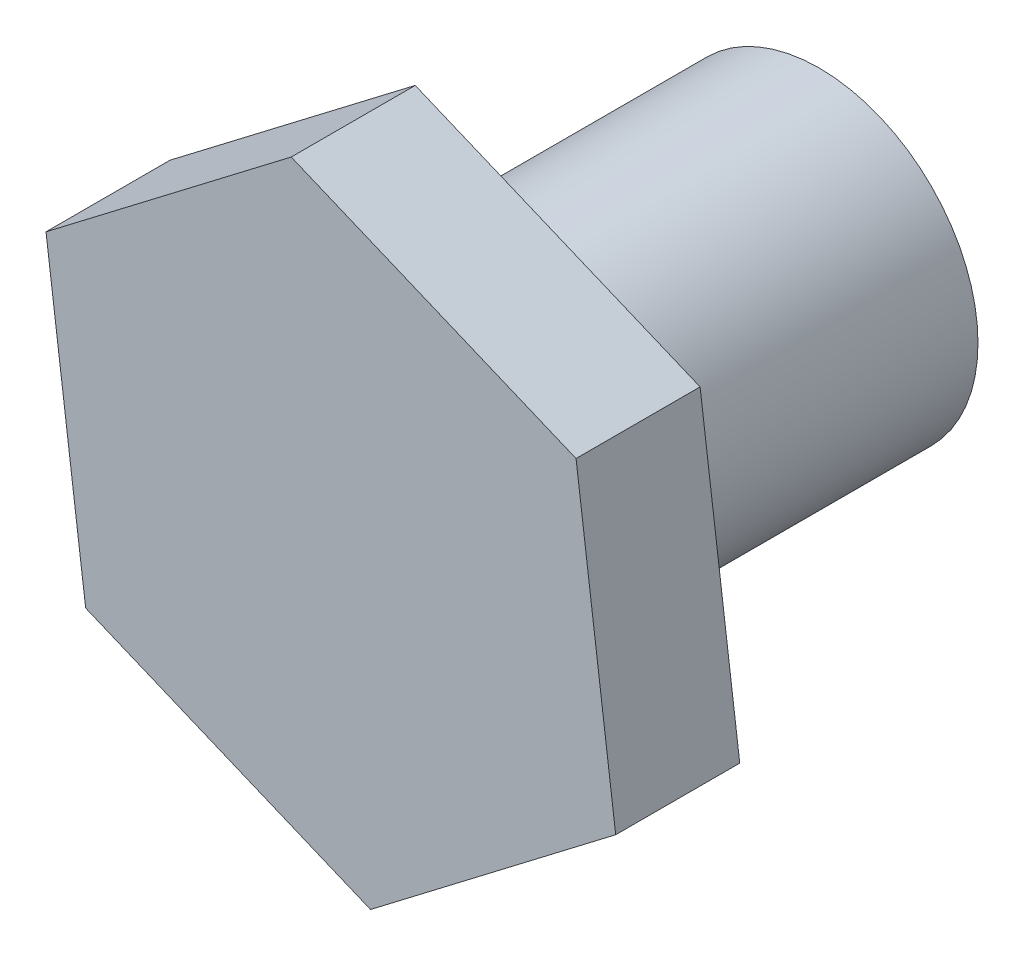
SolidWorks part; units mm, degrees
ref_plane "Front Plane" through (0, 0, 0) normal (0, 0, 1) x (1, 0, 0)
ref_plane "Top Plane" through (0, 0, 0) normal (0, 1, 0) x (1, 0, 0)
ref_plane "Right Plane" through (0, 0, 0) normal (1, 0, 0) x (0, 0, -1)
sketch "Sketch1" plane through (0, 0, 0) normal (0, 0, 1) x (1, 0, 0)
  circle A1 centre (-24.0117, 40.7938) radius 5.1998
extrude "Extrude1" add sketch "Sketch1" against normal blind 11.938
sketch "Sketch2" plane through (0, 0, 0) normal (0, 0, 1) x (1, 0, 0)
  line L1 (-22.7126, 30.768) -> (-14.6795, 36.906)
  line L2 (-14.6795, 36.906) -> (-15.9787, 46.9319)
  line L3 (-15.9787, 46.9319) -> (-25.3109, 50.8197)
  line L4 (-25.3109, 50.8197) -> (-33.3439, 44.6816)
  line L5 (-33.3439, 44.6816) -> (-32.0448, 34.6558)
  line L6 (-32.0448, 34.6558) -> (-22.7126, 30.768)
  circle A0 centre (-24.0117, 40.7938) radius 8.7552 construction
extrude "Extrude2" add sketch "Sketch2" along normal blind 4.064
